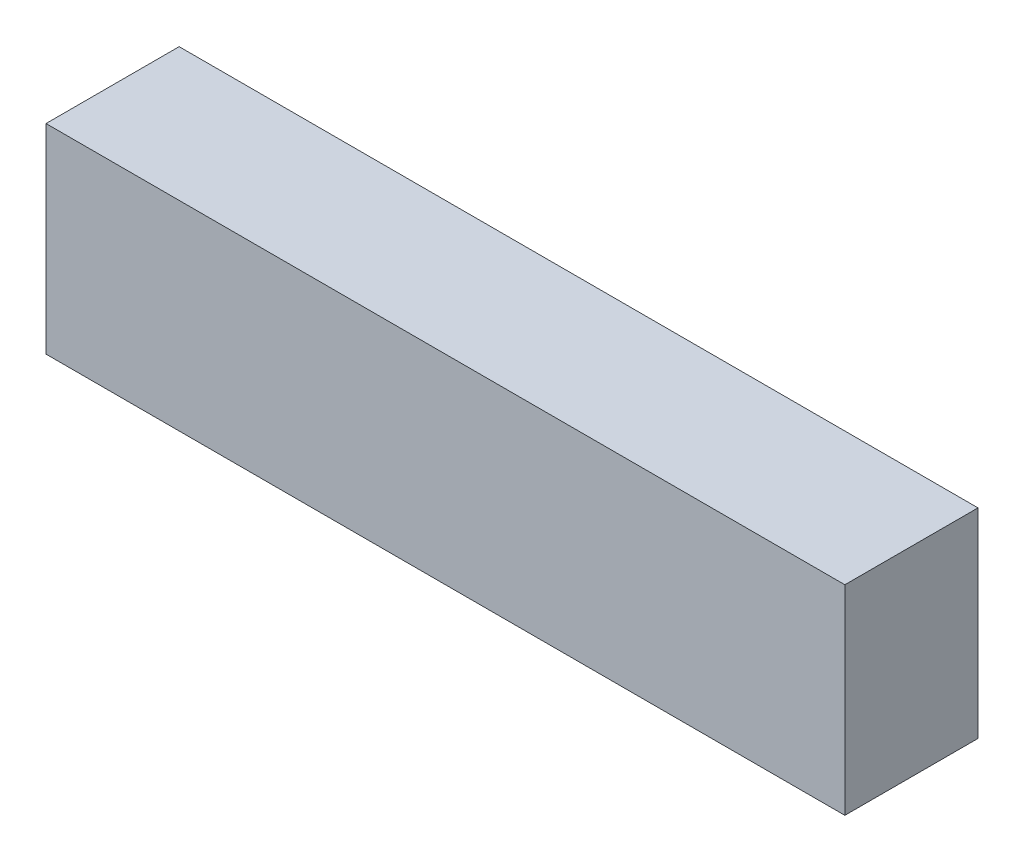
SolidWorks part; units mm, degrees
ref_plane "Plan de face" through (0, 0, 0) normal (0, 0, 1) x (1, 0, 0)
ref_plane "Plan de dessus" through (0, 0, 0) normal (0, 1, 0) x (1, 0, 0)
ref_plane "Plan de droite" through (0, 0, 0) normal (1, 0, 0) x (0, 0, -1)
sketch "Esquisse1" plane through (0, 0, 0) normal (0, 0, 1) x (1, 0, 0)
  line L1 (9, -2.25) -> (-9, -2.25)
  line L2 (9, -2.25) -> (9, 2.25)
  line L3 (9, 2.25) -> (-9, 2.25)
  line L4 (-9, -2.25) -> (-9, 2.25)
  line L5 (9, -2.25) -> (-9, 2.25) construction
  line L6 (9, 2.25) -> (-9, -2.25) construction
  point P0 (0, 0)
  dimension "D1" = 18
  dimension "D2" = 4.5
extrude "Boss.-Extru.1" add sketch "Esquisse1" along normal blind 3
